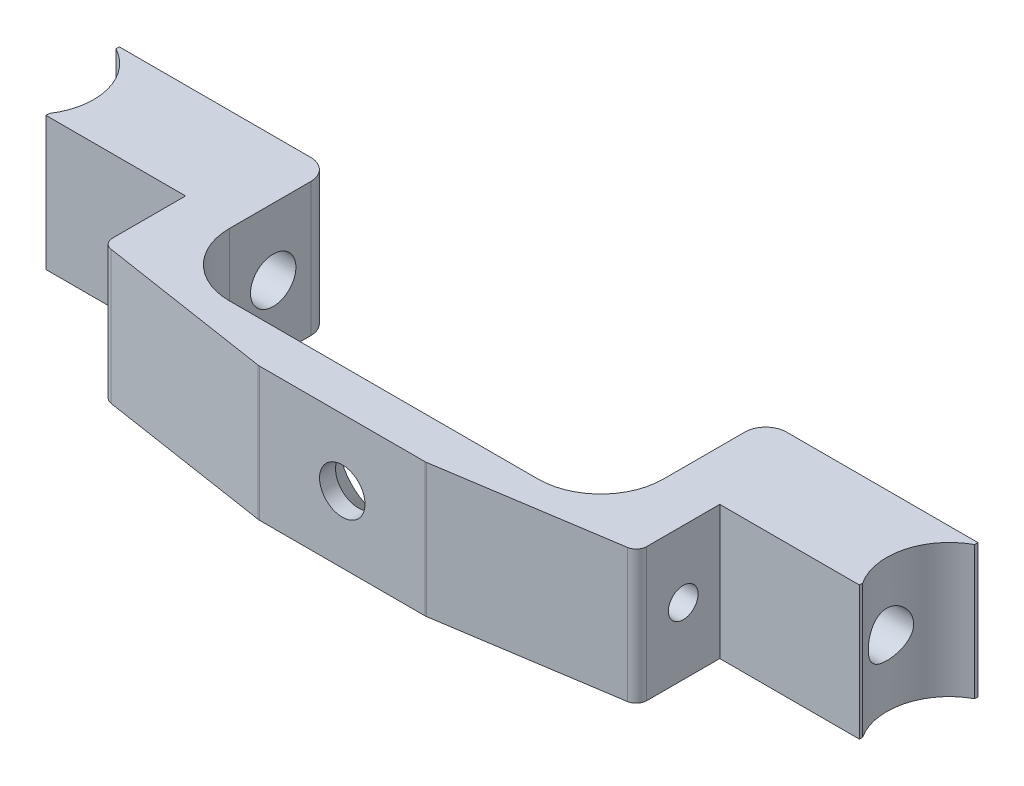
SolidWorks part; units mm, degrees
other "<wiringPanelTopBracket>-<CSK for #4 Flat Head Machine Screw1>"
ref_plane "Front Plane" through (0, 0, 0) normal (0, 0, 1) x (1, 0, 0)
ref_plane "Top Plane" through (0, 0, 0) normal (0, 1, 0) x (1, 0, 0)
ref_plane "Right Plane" through (0, 0, 0) normal (1, 0, 0) x (0, 0, -1)
ref_plane "Front Plane-wiringPanelTopBracket_Mirrored" through (0, 0, 0) normal (0, 0, 1) x (1, 0, 0)
ref_plane "Top Plane-wiringPanelTopBracket_Mirrored" through (0, 0, 0) normal (0, -1, 0) x (1, 0, 0)
ref_plane "Right Plane-wiringPanelTopBracket_Mirrored" through (0, 0, 0) normal (1, 0, 0) x (0, 0, -1)
mirrored part "wiringPanelTopBracket_Mirrored" parameters "D1.Boss-Extrude1"=2.54, "D1.Sketch1"=96.52, "D2.Sketch1"=4.7625, "D3.Sketch1"=4.7625, "D4.Sketch1"=3.81, "D5.Sketch1"=33.02, "D1.Boss-Extrude2"=7.62, "Thru Hole Dia..Sketch4"=4.9149, "Thru Hole Depth.Sketch4"=2.54, "D2.Hole Thread2"=4.1656, "D2.Hole Thread1"=4.1656, "Thru Tap Drill Dia..Sketch6"=3.4544, "Thru Tap Drill Depth.Sketch6"=2.54, "D6.Sketch1"=79.375, "D1.Sketch5"=25.4, "D2.Sketch5"=4.445, "D1.Sketch2"=0, "D3.Sketch2"=0, "D4.Sketch2"=0, "D5.Sketch2"=0, "D1.Fillet1"=1.5875, "Thread Major Dia..Sketch8"=2.2606, "Thru Tap Drill Depth.Sketch8"=60.0075, "Thru Hole Dia..Sketch10"=3.2639, "Thru Hole Depth.Sketch10"=4.5981, "Near C'Sink Dia..Sketch10"=6.819, "Near C'Sink Angle.Sketch10"=82
sketch "Sketch1" plane through (0, -2.54, 0) normal (0, 1, 0) x (1, 0, 0)
  line L16 (16.51, -83.3134) -> (16.51, -64.5017)
  line L17 (-16.51, -64.5017) -> (-16.51, -83.3134)
  line L18 (16.51, -83.3134) -> (16.51, -64.5017)
  line L19 (-16.51, -64.5017) -> (-16.51, -83.3134)
  line L32 (-39.6875, -55.1034) -> (-39.6875, -84.8509)
  line L33 (39.6875, -84.8509) -> (39.6875, -55.1034)
  line L34 (20.32, -64.3202) -> (20.32, -92.2359)
  line L35 (19.6475, -93.0203) -> (6.4103, -95.0661)
  line L36 (6.289, -95.0754) -> (-6.289, -95.0754)
  line L37 (-6.4103, -95.0661) -> (-19.6475, -93.0203)
  line L38 (-20.32, -92.2359) -> (-20.32, -64.3202)
  line L39 (-39.6875, -55.1034) -> (-39.6875, -84.8509)
  line L40 (39.6875, -84.8509) -> (39.6875, -55.1034)
  line L41 (20.32, -64.3202) -> (20.32, -92.2359)
  line L42 (19.6475, -93.0203) -> (6.4103, -95.0661)
  line L43 (6.289, -95.0754) -> (-6.289, -95.0754)
  line L44 (-6.4103, -95.0661) -> (-19.6475, -93.0203)
  line L45 (-20.32, -92.2359) -> (-20.32, -64.3202)
  arc A48 (17.6686, -62.9733) -> (16.51, -64.5017) centre (18.0975, -64.5017) ccw
  arc A49 (-17.6686, -62.9733) -> (17.6686, -62.9733) centre (0, 0) ccw
  arc A50 (-16.51, -64.5017) -> (-17.6686, -62.9733) centre (-18.0975, -64.5017) ccw
  arc A51 (-11.0825, -78.5975) -> (-16.51, -83.3134) centre (-11.7475, -83.3134) ccw
  arc A52 (-11.0825, -78.5975) -> (11.0825, -78.5975) centre (0, 0) ccw
  arc A53 (16.51, -83.3134) -> (11.0825, -78.5975) centre (11.7475, -83.3134) ccw
  arc A54 (17.6686, -62.9733) -> (16.51, -64.5017) centre (18.0975, -64.5017) ccw
  arc A55 (-17.6686, -62.9733) -> (17.6686, -62.9733) centre (0, 0) ccw
  arc A56 (-16.51, -64.5017) -> (-17.6686, -62.9733) centre (-18.0975, -64.5017) ccw
  arc A57 (-11.0825, -78.5975) -> (-16.51, -83.3134) centre (-11.7475, -83.3134) ccw
  arc A58 (-11.0825, -78.5975) -> (11.0825, -78.5975) centre (0, 0) ccw
  arc A59 (16.51, -83.3134) -> (11.0825, -78.5975) centre (11.7475, -83.3134) ccw
  arc A80 (-39.6875, -84.8509) -> (-36.7377, -89.255) centre (-34.925, -84.8509) ccw
  arc A81 (-36.7377, -89.255) -> (36.7377, -89.255) centre (0, 0) ccw
  arc A82 (36.7377, -89.255) -> (39.6875, -84.8509) centre (34.925, -84.8509) ccw
  arc A83 (39.6875, -55.1034) -> (37.1972, -53.7976) centre (38.1, -55.1034) ccw
  arc A84 (18.2886, -62.796) -> (37.1972, -53.7976) centre (0, 0) ccw
  arc A85 (20.32, -64.3202) -> (18.2886, -62.796) centre (18.7325, -64.3202) ccw
  arc A86 (19.6475, -93.0203) -> (20.32, -92.2359) centre (19.5263, -92.2359) ccw
  arc A87 (6.289, -95.0754) -> (6.4103, -95.0661) centre (6.289, -94.2816) ccw
  arc A88 (-6.4103, -95.0661) -> (-6.289, -95.0754) centre (-6.289, -94.2816) ccw
  arc A89 (-20.32, -92.2359) -> (-19.6475, -93.0203) centre (-19.5262, -92.2359) ccw
  arc A90 (-18.2886, -62.796) -> (-20.32, -64.3202) centre (-18.7325, -64.3202) ccw
  arc A91 (-37.1972, -53.7976) -> (-18.2886, -62.796) centre (0, 0) ccw
  arc A92 (-37.1972, -53.7976) -> (-39.6875, -55.1034) centre (-38.1, -55.1034) ccw
  arc A93 (-39.6875, -84.8509) -> (-36.7377, -89.255) centre (-34.925, -84.8509) ccw
  arc A94 (-36.7377, -89.255) -> (36.7377, -89.255) centre (0, 0) ccw
  arc A95 (36.7377, -89.255) -> (39.6875, -84.8509) centre (34.925, -84.8509) ccw
  arc A96 (39.6875, -55.1034) -> (37.1972, -53.7976) centre (38.1, -55.1034) ccw
  arc A97 (18.2886, -62.796) -> (37.1972, -53.7976) centre (0, 0) ccw
  arc A98 (20.32, -64.3202) -> (18.2886, -62.796) centre (18.7325, -64.3202) ccw
  arc A99 (19.6475, -93.0203) -> (20.32, -92.2359) centre (19.5263, -92.2359) ccw
  arc A100 (6.289, -95.0754) -> (6.4103, -95.0661) centre (6.289, -94.2816) ccw
  arc A101 (-6.4103, -95.0661) -> (-6.289, -95.0754) centre (-6.289, -94.2816) ccw
  arc A102 (-20.32, -92.2359) -> (-19.6475, -93.0203) centre (-19.5262, -92.2359) ccw
  arc A103 (-18.2886, -62.796) -> (-20.32, -64.3202) centre (-18.7325, -64.3202) ccw
  arc A104 (-37.1972, -53.7976) -> (-18.2886, -62.796) centre (0, 0) ccw
  arc A105 (-37.1972, -53.7976) -> (-39.6875, -55.1034) centre (-38.1, -55.1034) ccw
  dimension "D1" = 0
  dimension "D2" = 0
extrude "Cut-Extrude1" cut sketch "Sketch1" along normal through all
sketch "Sketch2" plane through (0, 0, 0) normal (0, 1, 0) x (1, 0, 0)
  line L0 (0, 0) -> (0, -69.0435) construction
  line L1 (-32.6629, -79.375) -> (-20.32, -79.375)
  line L2 (-32.6629, -79.375) -> (-32.6629, -79.629)
  line L3 (-32.6629, -88.265) -> (-20.32, -88.265)
  line L4 (32.6629, -79.375) -> (32.6629, -79.629)
  line L5 (-20.32, -79.375) -> (-20.32, -88.265)
  line L6 (-20.32, -92.2359) -> (-20.32, -64.3202) construction
  line L7 (20.32, -79.375) -> (20.32, -88.265)
  line L8 (20.32, -64.3202) -> (20.32, -92.2359) construction
  line L9 (20.32, -88.265) -> (32.6629, -88.265)
  line L10 (20.32, -79.375) -> (32.6629, -79.375)
  line L11 (-20.32, -83.82) -> (-34.925, -83.82) construction
  line L12 (-32.6629, -88.011) -> (-32.6629, -88.265)
  line L13 (32.6629, -88.011) -> (32.6629, -88.265)
  arc A0 (-32.6629, -88.011) -> (-32.6629, -79.629) centre (-34.925, -83.82) ccw
  arc A1 (32.6629, -88.011) -> (32.6629, -79.629) centre (34.925, -83.82) cw
  dimension "D2" = 9.525
  dimension "D1" = 8.89
  dimension "D3" = 8.382
extrude "Boss-Extrude1" add sketch "Sketch2" against normal up to surface and the other way up to surface
sketch "Sketch3" plane through (0, 7.62, 0) normal (0, 1, 0) x (1, 0, 0)
  line L29 (-20.32, -79.375) -> (-16.51, -79.375)
  line L30 (16.51, -79.375) -> (20.32, -79.375)
  line L47 (16.51, -64.5017) -> (16.51, -87.1594)
  line L48 (11.7475, -91.9219) -> (-11.7475, -91.9219)
  line L49 (-16.51, -87.1594) -> (-16.51, -64.5017)
  line L50 (-20.32, -64.3202) -> (-20.32, -79.375)
  line L51 (-20.32, -79.375) -> (-32.6629, -79.375)
  line L52 (-32.6629, -79.375) -> (-32.6629, -79.629)
  line L53 (-32.6629, -88.011) -> (-32.6629, -88.265)
  line L54 (-32.6629, -88.265) -> (-20.32, -88.265)
  line L55 (-20.32, -88.265) -> (-20.32, -92.2359)
  line L56 (-19.6475, -93.0203) -> (-6.4103, -95.0661)
  line L57 (-6.289, -95.0754) -> (6.289, -95.0754)
  line L58 (6.4103, -95.0661) -> (19.6475, -93.0203)
  line L59 (20.32, -92.2359) -> (20.32, -88.265)
  line L60 (20.32, -88.265) -> (32.6629, -88.265)
  line L61 (32.6629, -88.265) -> (32.6629, -88.011)
  line L62 (32.6629, -79.629) -> (32.6629, -79.375)
  line L63 (32.6629, -79.375) -> (20.32, -79.375)
  line L64 (20.32, -79.375) -> (20.32, -64.3202)
  line L65 (16.51, -64.5017) -> (16.51, -79.375)
  line L67 (-16.51, -79.375) -> (-16.51, -64.5017)
  line L68 (-20.32, -64.3202) -> (-20.32, -79.375)
  line L82 (20.32, -79.375) -> (20.32, -64.3202)
  arc A32 (17.6686, -62.9733) -> (18.2886, -62.796) centre (0, 0) ccw
  arc A33 (17.6686, -62.9733) -> (16.51, -64.5017) centre (18.0975, -64.5017) ccw
  arc A34 (11.7475, -91.9219) -> (16.51, -87.1594) centre (11.7475, -87.1594) ccw
  arc A35 (-16.51, -87.1594) -> (-11.7475, -91.9219) centre (-11.7475, -87.1594) ccw
  arc A36 (-16.51, -64.5017) -> (-17.6686, -62.9733) centre (-18.0975, -64.5017) ccw
  arc A37 (-18.2886, -62.796) -> (-17.6686, -62.9733) centre (0, 0) ccw
  arc A38 (-18.2886, -62.796) -> (-20.32, -64.3202) centre (-18.7325, -64.3202) ccw
  arc A39 (-32.6629, -88.011) -> (-32.6629, -79.629) centre (-34.925, -83.82) ccw
  arc A40 (-20.32, -92.2359) -> (-19.6475, -93.0203) centre (-19.5262, -92.2359) ccw
  arc A41 (-6.4103, -95.0661) -> (-6.289, -95.0754) centre (-6.289, -94.2816) ccw
  arc A42 (6.289, -95.0754) -> (6.4103, -95.0661) centre (6.289, -94.2816) ccw
  arc A43 (19.6475, -93.0203) -> (20.32, -92.2359) centre (19.5263, -92.2359) ccw
  arc A44 (32.6629, -79.629) -> (32.6629, -88.011) centre (34.925, -83.82) ccw
  arc A45 (20.32, -64.3202) -> (18.2886, -62.796) centre (18.7325, -64.3202) ccw
  arc A46 (17.6686, -62.9733) -> (18.2886, -62.796) centre (0, 0) ccw
  arc A47 (17.6686, -62.9733) -> (16.51, -64.5017) centre (18.0975, -64.5017) ccw
  arc A50 (-16.51, -64.5017) -> (-17.6686, -62.9733) centre (-18.0975, -64.5017) ccw
  arc A51 (-18.2886, -62.796) -> (-17.6686, -62.9733) centre (0, 0) ccw
  arc A52 (-18.2886, -62.796) -> (-20.32, -64.3202) centre (-18.7325, -64.3202) ccw
  arc A59 (20.32, -64.3202) -> (18.2886, -62.796) centre (18.7325, -64.3202) ccw
  dimension "D1" = 0
extrude "Cut-Extrude2" cut sketch "Sketch3" against normal through all
fillet "Fillet1" radius 1.5875 2 edges at (-20.32, 2.54, 88.265) (20.32, 2.54, 88.265)
hole_wizard "#8-32 Tapped Hole1" positions "Sketch4" profile "Sketch5" tap size "#8-32" standard "ANSI Inch"
sketch "Sketch4" plane through (-32.6629, 0, 0) normal (-1, 0, 0) x (0, 0, 1)
  line L0 (79.375, 7.62) -> (88.265, -2.54) construction
  point P6 (83.82, 2.54)
sketch "Sketch5" plane through (-32.6629, 2.54, 83.82) normal (0, 1, 0) x (0, 0, 1)
  line L0 (0, 0) -> (0, 65.3259)
  line L1 (0, 65.3259) -> (1.7272, 65.3259)
  line L2 (1.7272, 65.3259) -> (1.7272, 0)
  line L5 (1.7272, 0) -> (0, 0)
  line L11 (0, -6.35) -> (0, 107.95) construction
  dimension "Thread Major Dia." = 3.4544
  dimension "Thru Tap Drill Depth" = 65.3259
fillet "Fillet2" radius 1.5875 2 edges at (16.51, 2.54, 79.375) (-16.51, 2.54, 79.375)
sketch "Sketch6" plane through (0, 7.62, 0) normal (0, 1, 0) x (1, 0, 0)
  line L0 (32.6629, -88.265) -> (32.6629, -88.011) construction
  line L1 (32.6629, -86.6775) -> (31.115, -86.6775)
  line L2 (32.6629, -86.6775) -> (32.6629, -89.8525)
  line L3 (32.6629, -89.8525) -> (20.32, -89.8525)
  line L4 (20.32, -86.6775) -> (20.32, -89.8525)
  line L5 (30.9371, -86.6775) -> (30.9371, -86.4235)
  line L6 (32.6629, -79.629) -> (32.6629, -79.375) construction
  line L7 (30.9371, -86.6775) -> (20.32, -86.6775)
  line L8 (20.32, -90.5649) -> (20.32, -89.8525) construction
  line L9 (20.32, -89.8525) -> (20.32, -92.2359) construction
  arc A0 (30.9371, -86.4235) -> (31.115, -86.6775) centre (34.925, -83.82) ccw
  arc A2 (32.6629, -79.629) -> (32.6629, -88.011) centre (34.925, -83.82) ccw construction
  point P11 (20.32, -86.6775)
  dimension "D1" = 3.175
extrude "Cut-Extrude3" cut sketch "Sketch6" against normal through all
sketch "Sketch11" plane through (20.32, 0, 0) normal (1, 0, 0) x (0, 0, -1)
  circle A0 centre (-89.4346, 3.81) radius 1.1303
  circle A1 centre (-89.4346, 3.81) radius 1.1303 construction
extrude "Boss-Extrude3" add sketch "Sketch11" against normal up to surface (3.9497 mm away)
mirror "Mirror1" about plane through (0, 0, 0) normal (1, 0, 0) of "Cut-Extrude3"
sketch "Sketch9" plane through (0, 7.62, 0) normal (0, 1, 0) x (1, 0, 0)
  line L16 (20.32, -86.9474) -> (16.51, -86.9474)
  line L17 (-20.32, -86.9474) -> (-16.51, -86.9474)
  line L32 (-30.9371, -86.4235) -> (-30.9371, -86.6775)
  line L33 (-30.9371, -86.6775) -> (-20.32, -86.6775)
  line L34 (-20.32, -86.6775) -> (-20.32, -92.2359)
  line L35 (-19.6475, -93.0203) -> (-6.4103, -95.0661)
  line L36 (-6.289, -95.0754) -> (6.289, -95.0754)
  line L37 (6.4103, -95.0661) -> (19.6475, -93.0203)
  line L38 (20.32, -92.2359) -> (20.32, -86.6775)
  line L39 (20.32, -86.6775) -> (30.9371, -86.6775)
  line L40 (30.9371, -86.6775) -> (30.9371, -86.4235)
  line L41 (32.6629, -79.629) -> (32.6629, -79.375)
  line L42 (32.6629, -79.375) -> (18.0975, -79.375)
  line L43 (16.51, -80.9625) -> (16.51, -87.1594)
  line L44 (11.7475, -91.9219) -> (-11.7475, -91.9219)
  line L45 (-16.51, -87.1594) -> (-16.51, -80.9625)
  line L46 (-18.0975, -79.375) -> (-32.6629, -79.375)
  line L47 (-32.6629, -79.375) -> (-32.6629, -79.629)
  line L50 (-20.32, -86.9474) -> (-20.32, -92.2359)
  line L51 (-19.6475, -93.0203) -> (-6.4103, -95.0661)
  line L52 (-6.289, -95.0754) -> (6.289, -95.0754)
  line L53 (6.4103, -95.0661) -> (19.6475, -93.0203)
  line L54 (20.32, -92.2359) -> (20.32, -86.9474)
  line L59 (16.51, -86.9474) -> (16.51, -87.1594)
  line L60 (11.7475, -91.9219) -> (-11.7475, -91.9219)
  line L61 (-16.51, -87.1594) -> (-16.51, -86.9474)
  arc A24 (-30.9371, -86.4235) -> (-32.6629, -79.629) centre (-34.925, -83.82) ccw
  arc A26 (-20.32, -92.2359) -> (-19.6475, -93.0203) centre (-19.5262, -92.2359) ccw
  arc A27 (-6.4103, -95.0661) -> (-6.289, -95.0754) centre (-6.289, -94.2816) ccw
  arc A28 (6.289, -95.0754) -> (6.4103, -95.0661) centre (6.289, -94.2816) ccw
  arc A29 (19.6475, -93.0203) -> (20.32, -92.2359) centre (19.5263, -92.2359) ccw
  arc A31 (32.6629, -79.629) -> (30.9371, -86.4235) centre (34.925, -83.82) ccw
  arc A32 (18.0975, -79.375) -> (16.51, -80.9625) centre (18.0975, -80.9625) ccw
  arc A33 (11.7475, -91.9219) -> (16.51, -87.1594) centre (11.7475, -87.1594) ccw
  arc A34 (-16.51, -87.1594) -> (-11.7475, -91.9219) centre (-11.7475, -87.1594) ccw
  arc A35 (-16.51, -80.9625) -> (-18.0975, -79.375) centre (-18.0975, -80.9625) ccw
  arc A38 (-20.32, -92.2359) -> (-19.6475, -93.0203) centre (-19.5262, -92.2359) ccw
  arc A39 (-6.4103, -95.0661) -> (-6.289, -95.0754) centre (-6.289, -94.2816) ccw
  arc A40 (6.289, -95.0754) -> (6.4103, -95.0661) centre (6.289, -94.2816) ccw
  arc A41 (19.6475, -93.0203) -> (20.32, -92.2359) centre (19.5263, -92.2359) ccw
  arc A45 (11.7475, -91.9219) -> (16.51, -87.1594) centre (11.7475, -87.1594) ccw
  arc A46 (-16.51, -87.1594) -> (-11.7475, -91.9219) centre (-11.7475, -87.1594) ccw
  dimension "D1" = 0
extrude "Boss-Extrude2" [suppressed] add sketch "Sketch9" along normal blind 8.89
sketch "Sketch12" plane through (-20.32, 0, 0) normal (-1, 0, 0) x (0, 0, 1)
  circle A0 centre (89.4346, 3.81) radius 1.1303
  circle A1 centre (89.4346, 3.81) radius 1.1303 construction
extrude "Boss-Extrude4" add sketch "Sketch12" against normal up to surface (5.2433 mm away)
hole_wizard "#4-40 Tapped Hole1" positions "Sketch7" profile "Sketch8" tap size "#4-40" standard "ANSI Inch"
sketch "Sketch7" plane through (20.32, 0, 0) normal (1, 0, 0) x (0, 0, -1)
  line L3 (-92.2359, -2.54) -> (-86.6775, 7.62) construction
  point P7 (-89.4567, 2.54)
sketch "Sketch8" plane through (20.32, 2.54, 89.4567) normal (0, 1, 0) x (0, 0, -1)
  line L0 (0, 0) -> (0, 52.9829)
  line L1 (0, 52.9829) -> (1.1303, 52.9829)
  line L2 (1.1303, 52.9829) -> (1.1303, 0)
  line L5 (1.1303, 0) -> (0, 0)
  line L11 (0, -6.35) -> (0, 107.95) construction
  dimension "Thru Tap Drill Dia." = 2.2606
  dimension "Thru Tap Drill Depth" = 52.9829
sketch "Sketch15" plane through (0, 0, 91.9219) normal (0, 0, -1) x (-1, 0, 0)
  circle A0 centre (0, 3.81) radius 3.4095
  circle A1 centre (0, 3.81) radius 3.4095 construction
extrude "Boss-Extrude5" add sketch "Sketch15" against normal up to surface (3.1535 mm away)
hole_wizard "CSK for #4 Flat Head Machine Screw1" positions "Sketch13" profile "Sketch14" countersink size "#4" standard "ANSI Inch"
sketch "Sketch13" plane through (0, 0, 91.9219) normal (0, 0, -1) x (-1, 0, 0)
  line L4 (0, 7.62) -> (0, -2.54) construction
  line L5 (11.7475, 7.62) -> (-11.7475, 7.62) construction
  line L6 (11.7475, -2.54) -> (-11.7475, -2.54) construction
  point P0 (0, 2.54)
sketch "Sketch14" plane through (0, 2.54, 91.9219) normal (1, 0, 0) x (0, 1, 0)
  line L0 (0, 0) -> (0, 3.1535)
  line L1 (0, 3.1535) -> (1.7272, 3.1535)
  line L2 (1.7272, 3.1535) -> (1.7272, 1.9353)
  line L3 (1.7272, 1.9353) -> (3.4095, 0)
  line L5 (3.4095, 0) -> (0, 0)
  line L6 (-1.7272, 1.9353) -> (-3.4095, 0) construction
  line L11 (0, -6.35) -> (0, 107.95) construction
  dimension "Thru Hole Dia." = 3.4544
  dimension "Thru Hole Depth" = 3.1535
  dimension "Near C'Sink Dia." = 6.819
  dimension "Near C'Sink Angle" = 82
